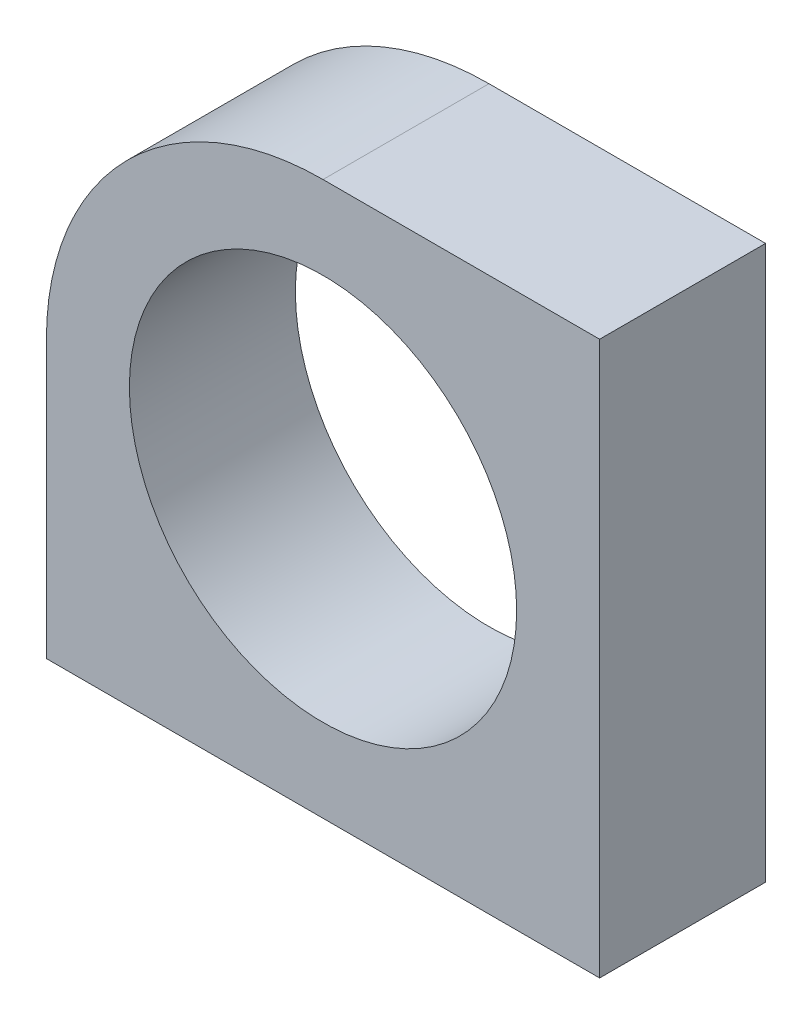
SolidWorks part; units mm, degrees
ref_plane "Front Plane" through (0, 0, 0) normal (0, 0, 1) x (1, 0, 0)
ref_plane "Top Plane" through (0, 0, 0) normal (0, 1, 0) x (1, 0, 0)
ref_plane "Right Plane" through (0, 0, 0) normal (1, 0, 0) x (0, 0, -1)
sketch "Sketch1" plane through (0, 0, 0) normal (0, 0, 1) x (1, 0, 0)
  line L1 (0, 0) -> (10, 0)
  line L2 (0, 0) -> (0, 10)
  line L3 (0, 10) -> (10, 10)
  line L4 (10, 0) -> (10, 10)
  dimension "D1" = 10
  dimension "D2" = 10
extrude "Boss-Extrude1" add sketch "Sketch1" along normal blind 3
fillet "Fillet1" radius 5 1 edges at (0, 10, 1.5)
sketch "Sketch2" plane through (0, 0, 3) normal (0, 0, 1) x (1, 0, 0)
  circle A0 centre (5, 5) radius 3.5
  dimension "D1" = 7
extrude "Cut-Extrude1" cut sketch "Sketch2" against normal blind 4
